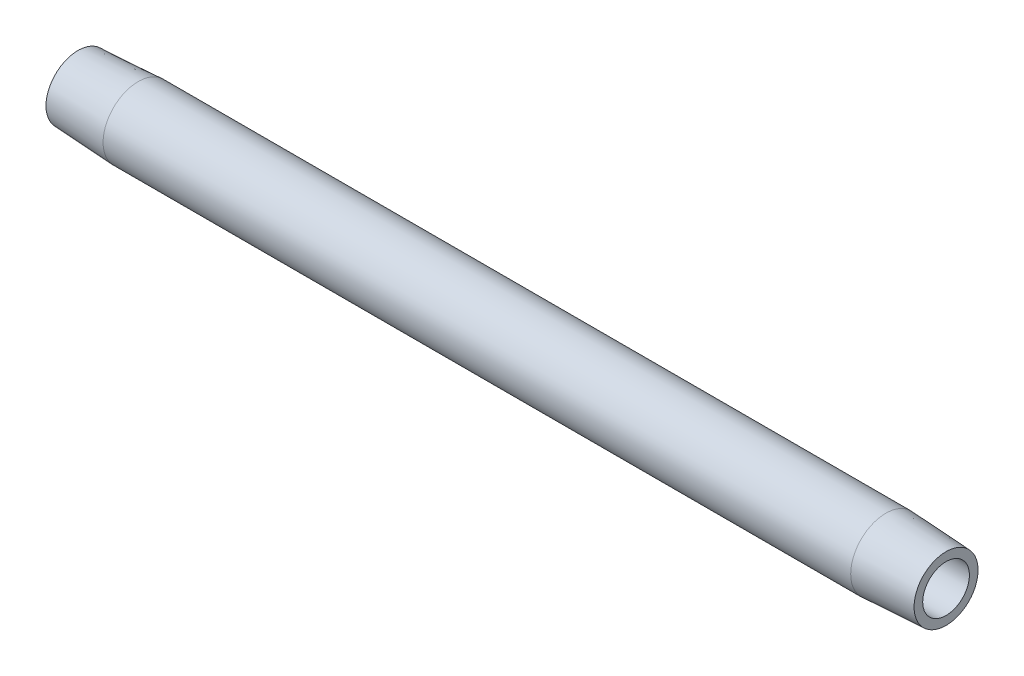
SolidWorks part; units mm, degrees
ref_plane "Front Plane" through (0, 0, 0) normal (0, 0, 1) x (1, 0, 0)
ref_plane "Top Plane" through (0, 0, 0) normal (0, 1, 0) x (1, 0, 0)
ref_plane "Right Plane" through (0, 0, 0) normal (1, 0, 0) x (0, 0, -1)
sketch "Sketch2" plane through (0, 0, 0) normal (0, 0, 1) x (1, 0, 0)
  line L0 (0.4761, 0) -> (50000.4761, 0) construction
  line L1 (0, -11.3625) -> (0, 49988.6375) construction
  line L7 (8.81, 5.1435) -> (0, 4.6818)
  line L8 (118.19, 5.1435) -> (8.81, 5.1435)
  line L9 (127, 4.6818) -> (118.19, 5.1435)
  line L10 (127, 3.4163) -> (127, 4.6818)
  line L11 (127, 3.4163) -> (0, 3.4163)
  line L12 (0, 4.6818) -> (0, 3.4163)
  dimension "D1" = 6.8326
  dimension "D2" = 10.287
  dimension "D3" = 3
  dimension "D4" = 3
  dimension "D5" = 8.81
  dimension "D6" = 8.81
  dimension "D7" = 127
revolve "Revolve1" add sketch "Sketch2" angle 360 about L0
